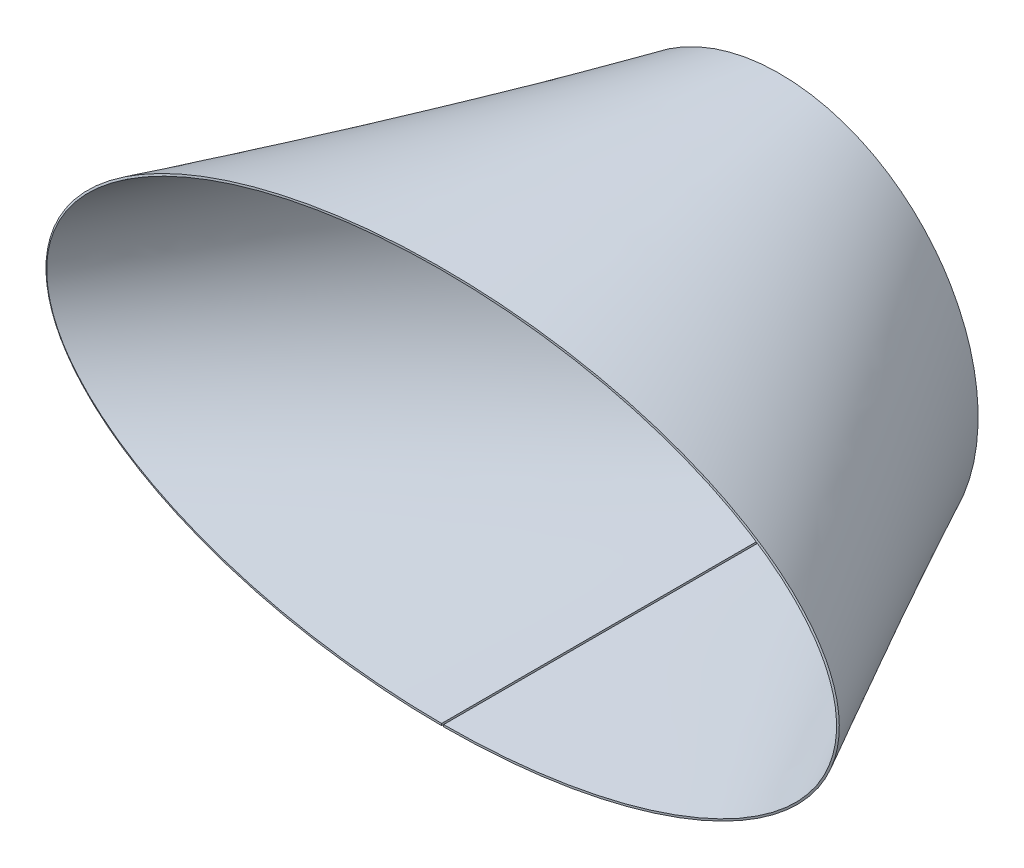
SolidWorks part; units mm, degrees
ref_plane "前视基准面" through (0, 0, 0) normal (0, 0, 1) x (1, 0, 0)
ref_plane "上视基准面" through (0, 0, 0) normal (0, 1, 0) x (1, 0, 0)
ref_plane "右视基准面" through (0, 0, 0) normal (1, 0, 0) x (0, 0, -1)
sketch "草图1" plane through (0, 0, 0) normal (0, 0, 1) x (1, 0, 0)
  line L0 (-0.5, -99.9987) -> (-0.5, 0) construction
  line L1 (-0.5, 0) -> (0.5, 0) construction
  line L2 (0.5, 0) -> (0.5, -99.9987) construction
  arc A0 (0.5, -99.9987) -> (-0.5, -99.9987) centre (0, 0) ccw
  dimension "r" = 100
  dimension "D1" = 1
ref_plane "基准面1" through (0, 0, 170) normal (0, 0, 1) x (1, 0, 0)
sketch "草图2" plane through (0, 0, 170) normal (0, 0, 1) x (1, 0, 0)
  line L0 (-200, 0) -> (200, 0) construction
  line L1 (0, 100) -> (0, -100) construction
  line L2 (-0.5, -99.9997) -> (-0.5, 0) construction
  line L3 (-0.5, 0) -> (0.5, 0) construction
  line L4 (0.5, 0) -> (0.5, -99.9997) construction
  ellipse E0 centre (0, 0) end of major axis (200, 0) minor radius 100 (0.5, -99.9997) -> (-0.5, -99.9997) ccw
  dimension "D1" = 1
  dimension "a" = 400
  dimension "b" = 200
sheet metal parameters "钣金1" thickness 1 parameters "D1"=0.7366, "厚度"=1
lofted bend "放样折弯1" thickness 1 parameters "D1"=0, "D12"=1
other "自由形折弯1" parameters "D1"=1000, "D4"=57.296, "D5"=1
flat pattern "平板型式1"
sketch "折弯-线1" plane through (-0.4088, -96.6876, 17.8937) normal (-0.0042, -0.9833, 0.182) x (1, -0.0041, 0.0008)
  line L0 (-0.0912, -18.1974) -> (-0.0912, 154.6893) construction
  line L1 (-594.2847, 151.4967) -> (-502.9961, 298.317) construction
other "展开-<自由形折弯1>1"
